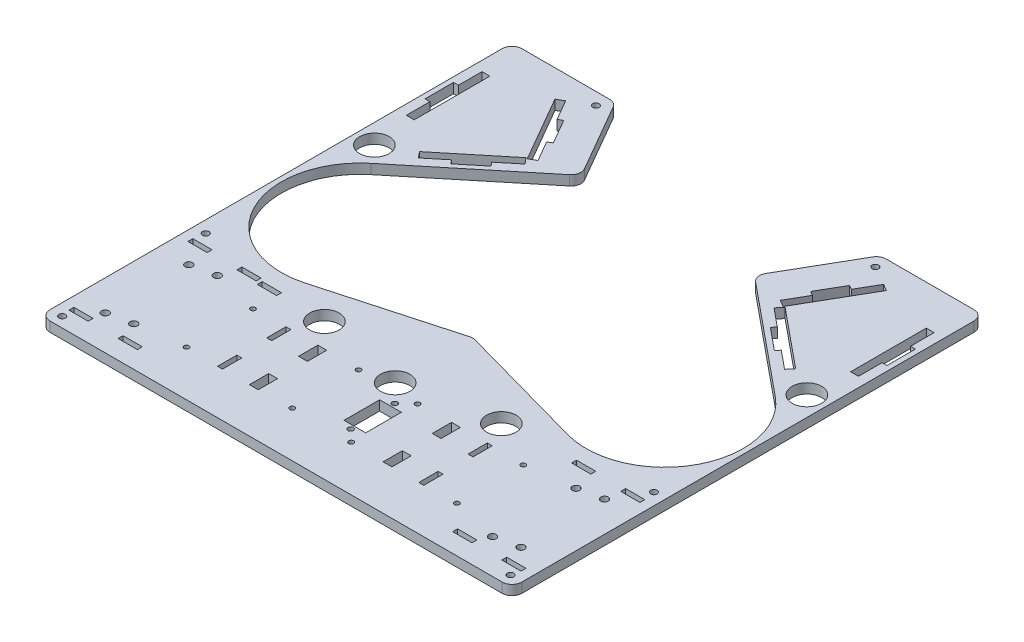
SolidWorks part; units mm, degrees
ref_plane "Front" through (0, 0, 0) normal (0, 0, 1) x (1, 0, 0)
ref_plane "Top" through (0, 0, 0) normal (0, 1, 0) x (1, 0, 0)
ref_plane "Right" through (0, 0, 0) normal (1, 0, 0) x (0, 0, -1)
sketch "Sketch1" plane through (0, 0, 0) normal (0, 1, 0) x (1, 0, 0)
  line L0 (-146.05, 0) -> (146.05, 0)
  line L1 (-152.4, 6.35) -> (-152.4, 298.45)
  line L2 (-149.225, 263.8519) -> (-152.4, 263.8519) construction
  line L3 (-83.1152, 262.2232) -> (-66.6174, 271.7482) construction
  line L4 (-58.5756, 257.8194) -> (-83.8668, 301.625)
  line L5 (-60.0496, 249.7331) -> (-130.6265, 191.8892)
  line L6 (-85.8648, 260.6357) -> (-78.2448, 247.4375)
  line L7 (-66.6125, 72.9976) -> (-63.4375, 72.9976)
  line L8 (-66.6125, 72.9976) -> (-66.6125, 60.5516)
  line L9 (-66.6125, 60.5516) -> (-63.4375, 60.5516)
  line L10 (-63.4375, 72.9976) -> (-63.4375, 60.5516)
  line L11 (-46.0375, 72.9976) -> (-40.3225, 72.9976)
  line L12 (-46.0375, 72.9976) -> (-46.0375, 60.5516)
  line L13 (-46.0375, 60.5516) -> (-40.3225, 60.5516)
  line L14 (-146.05, 263.8519) -> (-146.05, 279.0919)
  line L15 (-40.3225, 72.9976) -> (-40.3225, 60.5516)
  line L16 (-1108.9025, 50.8996) -> (48891.0975, 50.8996) construction
  line L17 (-40.3225, 28.8016) -> (-40.3225, 41.2476)
  line L18 (-46.0375, 41.2476) -> (-40.3225, 41.2476)
  line L19 (1.7012, 126.7679) -> (84.8154, 103.6562)
  line L20 (-146.05, 304.8) -> (-89.366, 304.8)
  line L21 (0, -1000) -> (0, 49000) construction
  line L22 (-1.7012, 126.7679) -> (-84.8154, 103.6562)
  line L23 (-146.05, 279.0919) -> (-140.97, 279.0919)
  line L24 (-98.425, 152.5992) -> (98.425, 152.5992) construction
  line L25 (-98.425, 152.5992) -> (0, 177.8) construction
  line L26 (0, 177.8) -> (98.425, 152.5992) construction
  line L27 (146.05, 304.8) -> (89.366, 304.8)
  line L28 (60.0496, 249.7331) -> (130.6265, 191.8892)
  line L29 (58.5756, 257.8194) -> (83.8668, 301.625)
  line L30 (152.4, 6.35) -> (152.4, 298.45)
  line L31 (-46.0375, 28.8016) -> (-46.0375, 41.2476)
  line L32 (-146.05, 230.1969) -> (-140.97, 230.1969)
  line L33 (-146.05, 245.4369) -> (-146.05, 230.1969)
  line L34 (-140.97, 279.0919) -> (-140.97, 230.1969)
  line L35 (-78.2448, 247.4375) -> (-82.6442, 244.8975)
  line L36 (-83.1152, 262.2232) -> (-85.8648, 260.6357)
  line L37 (-83.1152, 262.2232) -> (-92.3227, 278.1711)
  line L38 (-104.472, 217.4302) -> (-102.4594, 214.9746) construction
  line L39 (-106.4846, 219.8859) -> (-118.2716, 210.2254)
  line L40 (-149.225, 263.8519) -> (-146.05, 263.8519)
  line L41 (-149.225, 263.8519) -> (-149.225, 245.4369)
  line L42 (-149.225, 245.4369) -> (-146.05, 245.4369)
  line L43 (-118.2716, 210.2254) -> (-121.4917, 214.1544)
  line L44 (-104.472, 217.4302) -> (-106.4846, 219.8859)
  line L45 (-104.472, 217.4302) -> (-90.2294, 229.1033)
  line L46 (-117.708, 304.8) -> (-117.708, 202.477) construction
  line L47 (-146.05, 89.027) -> (-146.05, 92.202)
  line L48 (-146.05, 89.027) -> (-133.604, 89.027)
  line L49 (-133.604, 89.027) -> (-133.604, 92.202)
  line L50 (107.0917, 287.2418) -> (82.6442, 244.8975)
  line L51 (-46.0375, 28.8016) -> (-40.3225, 28.8016)
  line L52 (-63.4375, 28.8016) -> (-63.4375, 41.2476)
  line L53 (-66.6125, 41.2476) -> (-63.4375, 41.2476)
  line L54 (-66.6125, 28.8016) -> (-66.6125, 41.2476)
  line L55 (-66.6125, 28.8016) -> (-63.4375, 28.8016)
  line L56 (66.6125, 28.8016) -> (63.4375, 28.8016)
  line L57 (-90.2294, 229.1033) -> (-92.242, 231.5589)
  line L58 (-80.455, 241.2194) -> (-83.6751, 245.1484)
  line L59 (-92.242, 231.5589) -> (-80.455, 241.2194)
  line L60 (-121.4917, 214.1544) -> (-83.6751, 245.1484)
  line L61 (66.6125, 28.8016) -> (66.6125, 41.2476)
  line L62 (66.6125, 41.2476) -> (63.4375, 41.2476)
  line L63 (63.4375, 28.8016) -> (63.4375, 41.2476)
  line L64 (46.0375, 28.8016) -> (40.3225, 28.8016)
  line L65 (46.0375, 28.8016) -> (46.0375, 41.2476)
  line L66 (46.0375, 41.2476) -> (40.3225, 41.2476)
  line L67 (40.3225, 28.8016) -> (40.3225, 41.2476)
  line L68 (40.3225, 72.9976) -> (40.3225, 60.5516)
  line L69 (46.0375, 60.5516) -> (40.3225, 60.5516)
  line L70 (46.0375, 72.9976) -> (46.0375, 60.5516)
  line L71 (46.0375, 72.9976) -> (40.3225, 72.9976)
  line L72 (63.4375, 72.9976) -> (63.4375, 60.5516)
  line L73 (-92.3227, 278.1711) -> (-95.0723, 276.5836)
  line L74 (-102.6923, 289.7818) -> (-107.0917, 287.2418)
  line L75 (-95.0723, 276.5836) -> (-102.6923, 289.7818)
  line L76 (-107.0917, 287.2418) -> (-82.6442, 244.8975)
  line L77 (66.6125, 60.5516) -> (63.4375, 60.5516)
  line L78 (66.6125, 72.9976) -> (66.6125, 60.5516)
  line L79 (66.6125, 72.9976) -> (63.4375, 72.9976)
  line L80 (95.0723, 276.5836) -> (102.6923, 289.7818)
  line L81 (102.6923, 289.7818) -> (107.0917, 287.2418)
  line L82 (92.3227, 278.1711) -> (95.0723, 276.5836)
  line L83 (121.4917, 214.1544) -> (83.6751, 245.1484)
  line L84 (92.242, 231.5589) -> (80.455, 241.2194)
  line L85 (80.455, 241.2194) -> (83.6751, 245.1484)
  line L86 (90.2294, 229.1033) -> (92.242, 231.5589)
  line L87 (104.472, 217.4302) -> (90.2294, 229.1033)
  line L88 (-71.2212, 279.7222) -> (43230.049, 25279.7222) construction
  line L89 (-95.3381, 220.8111) -> (31599.0975, -38450.4024) construction
  line L90 (104.472, 217.4302) -> (106.4846, 219.8859)
  line L91 (118.2716, 210.2254) -> (121.4917, 214.1544)
  line L92 (149.225, 245.4369) -> (146.05, 245.4369)
  line L93 (149.225, 263.8519) -> (149.225, 245.4369)
  line L94 (149.225, 263.8519) -> (146.05, 263.8519)
  line L95 (106.4846, 219.8859) -> (118.2716, 210.2254)
  line L96 (-65.025, 60.5516) -> (-65.025, 41.2476) construction
  line L97 (83.1152, 262.2232) -> (92.3227, 278.1711)
  line L98 (83.1152, 262.2232) -> (85.8648, 260.6357)
  line L99 (78.2448, 247.4375) -> (82.6442, 244.8975)
  line L100 (140.97, 279.0919) -> (140.97, 230.1969)
  line L101 (146.05, 245.4369) -> (146.05, 230.1969)
  line L102 (-64.0748, 254.6444) -> (-50064.0748, 254.6444) construction
  line L103 (146.05, 230.1969) -> (140.97, 230.1969)
  line L104 (146.05, 279.0919) -> (140.97, 279.0919)
  line L105 (146.05, 263.8519) -> (146.05, 279.0919)
  line L106 (85.8648, 260.6357) -> (78.2448, 247.4375)
  line L107 (-146.05, 92.202) -> (-133.604, 92.202)
  line L108 (-101.854, 92.202) -> (-114.3, 92.202)
  line L109 (-114.3, 89.027) -> (-114.3, 92.202)
  line L110 (-101.854, 89.027) -> (-114.3, 89.027)
  line L111 (-101.854, 89.027) -> (-101.854, 92.202)
  line L112 (-133.604, 90.6145) -> (-114.3, 90.6145) construction
  line L113 (-101.854, 15.367) -> (-101.854, 12.192)
  line L114 (-101.854, 15.367) -> (-114.3, 15.367)
  line L115 (-114.3, 15.367) -> (-114.3, 12.192)
  line L116 (-101.854, 12.192) -> (-114.3, 12.192)
  line L117 (-146.05, 12.192) -> (-133.604, 12.192)
  line L118 (-133.604, 15.367) -> (-133.604, 12.192)
  line L119 (-146.05, 15.367) -> (-133.604, 15.367)
  line L120 (-146.05, 15.367) -> (-146.05, 12.192)
  line L121 (101.854, 89.027) -> (101.854, 92.202)
  line L122 (101.854, 89.027) -> (114.3, 89.027)
  line L123 (114.3, 89.027) -> (114.3, 92.202)
  line L124 (101.854, 92.202) -> (114.3, 92.202)
  line L125 (146.05, 92.202) -> (133.604, 92.202)
  line L126 (133.604, 89.027) -> (133.604, 92.202)
  line L127 (146.05, 89.027) -> (133.604, 89.027)
  line L128 (146.05, 89.027) -> (146.05, 92.202)
  line L129 (101.854, 12.192) -> (114.3, 12.192)
  line L130 (114.3, 15.367) -> (114.3, 12.192)
  line L131 (101.854, 15.367) -> (114.3, 15.367)
  line L132 (101.854, 15.367) -> (101.854, 12.192)
  line L133 (146.05, 15.367) -> (146.05, 12.192)
  line L134 (146.05, 15.367) -> (133.604, 15.367)
  line L135 (133.604, 15.367) -> (133.604, 12.192)
  line L136 (146.05, 12.192) -> (133.604, 12.192)
  line L137 (-98.425, 101.7992) -> (-98.425, 0) construction
  line L138 (-87.122, 87.4121) -> (-87.122, 90.5871)
  line L139 (-99.568, 90.5871) -> (-87.122, 90.5871)
  line L140 (-99.568, 87.4121) -> (-99.568, 90.5871)
  line L141 (-99.568, 87.4121) -> (-87.122, 87.4121)
  line L142 (-87.3125, 72.3309) -> (-87.3125, 29.4684) construction
  line L143 (-87.3125, 29.4684) -> (-19.05, 29.4684) construction
  line L144 (-19.05, 29.4684) -> (-19.05, 72.3309) construction
  line L145 (-19.05, 72.3309) -> (-87.3125, 72.3309) construction
  line L146 (4.4827, 62.3996) -> (18.4827, 62.3996)
  line L147 (4.4827, 62.3996) -> (4.4827, 39.3996)
  line L148 (4.4827, 39.3996) -> (18.4827, 39.3996)
  line L149 (18.4827, 62.3996) -> (18.4827, 39.3996)
  line L150 (11.4827, 62.3996) -> (11.4827, 39.3996) construction
  circle A0 centre (-98.425, 152.5992) radius 50.8 construction
  circle A1 centre (0, 76.9346) radius 9.525
  circle A2 centre (-144.78, 99.314) radius 2.0955
  circle A3 centre (0, 177.8) radius 50.8 construction
  circle A4 centre (98.425, 152.5992) radius 50.8 construction
  circle A5 centre (-144.78, 6.604) radius 2.0955
  arc A6 (-130.6265, 191.8892) -> (-84.8154, 103.6562) centre (-98.425, 152.5992) ccw
  circle A7 centre (144.78, 6.604) radius 2.0955
  circle A8 centre (144.78, 99.314) radius 2.0955
  arc A9 (-146.05, 0) -> (-152.4, 6.35) centre (-146.05, 6.35) cw
  arc A10 (-58.5756, 257.8194) -> (-60.0496, 249.7331) centre (-64.0748, 254.6444) cw
  circle A11 centre (-144.78, 99.314) radius 4.7625 construction
  arc A12 (-152.4, 298.45) -> (-146.05, 304.8) centre (-146.05, 298.45) cw
  circle A13 centre (-117.475, 79.4746) radius 2.3813
  circle A14 centre (-132.715, 76.2996) radius 2.3813
  circle A15 centre (117.475, 76.2996) radius 2.3813
  circle A16 centre (132.715, 79.4746) radius 2.3813
  arc A17 (-89.366, 304.8) -> (-83.8668, 301.625) centre (-89.366, 298.45) cw
  arc A18 (89.366, 304.8) -> (83.8668, 301.625) centre (89.366, 298.45) ccw
  arc A19 (152.4, 298.45) -> (146.05, 304.8) centre (146.05, 298.45) ccw
  arc A20 (58.5756, 257.8194) -> (60.0496, 249.7331) centre (64.0748, 254.6444) ccw
  arc A21 (146.05, 0) -> (152.4, 6.35) centre (146.05, 6.35) ccw
  arc A22 (130.6265, 191.8892) -> (84.8154, 103.6562) centre (98.425, 152.5992) cw
  circle A23 centre (-132.715, 22.3246) radius 2.3813
  circle A24 centre (-117.475, 25.4996) radius 2.3813
  arc A25 (-1.7012, 126.7679) -> (1.7012, 126.7679) centre (0, 120.65) cw
  circle A26 centre (117.475, 22.3246) radius 2.3813
  circle A27 centre (132.715, 25.4996) radius 2.3813
  circle A28 centre (-57.15, 88.3646) radius 9.525
  circle A29 centre (57.15, 88.3646) radius 9.525
  circle A30 centre (-87.3125, 29.4684) radius 1.5875
  circle A31 centre (-19.05, 29.4684) radius 1.5875
  circle A32 centre (-87.3125, 72.3309) radius 1.5875
  circle A33 centre (-19.05, 72.3309) radius 1.5875
  circle A34 centre (87.3125, 72.3309) radius 1.5875
  circle A35 centre (19.05, 72.3309) radius 1.5875
  circle A36 centre (19.05, 29.4684) radius 1.5875
  circle A37 centre (87.3125, 29.4684) radius 1.5875
  circle A38 centre (-139.7, 203.2) radius 9.525
  circle A39 centre (139.7, 203.2) radius 9.525
  circle A40 centre (-90.2826, 296.8625) radius 2.0955
  circle A41 centre (90.2826, 296.8625) radius 2.0955
  circle A42 centre (11.4827, 65.1496) radius 1.75
  circle A43 centre (11.4827, 36.6496) radius 1.75
  point P3 (-149.225, 254.6444)
  point P8 (-87.719, 270.1972)
  point P17 (-55.88, 253.1505)
  point P26 (-97.3507, 223.2668)
  point P31 (-152.4, 0)
  point P32 (0, 0)
  point P42 (0, 127)
  point P118 (55.88, 253.1505)
  point P125 (-123.952, 90.6145)
  point P166 (-71.2212, 279.7222)
  point P169 (-95.3381, 220.8111)
  point P181 (-65.025, 50.8996)
  point P194 (-98.425, 50.8996)
  point P228 (-19.05, 50.8996)
  point P249 (4.4827, 50.8996)
  dimension "D8" = 3.175
  dimension "D9" = 5.08
  dimension "D11" = 26.035
  dimension "D12" = 56.684
  dimension "D13" = 18.415
  dimension "D15" = 196.85
  dimension "D16" = 6.35
  dimension "D21" = 304.8
  dimension "D23" = 55.88
  dimension "D24" = 6.35
  dimension "D25" = 127
  dimension "D26" = 6.35
  dimension "D6" = 53.975
  dimension "D10" = 101.6
  dimension "D27" = 4.191
  dimension "D30" = 4.7625
  dimension "D37" = 19.05
  dimension "D40" = 3.175
  dimension "D46" = 19.05
  dimension "D47" = 12.192
  dimension "D52" = 9.525
  dimension "D55" = 3.5
  dimension "D3" = 17.4
  dimension "D4" = 3.175
  dimension "D5" = 12.446
  dimension "D7" = 15.24
  dimension "D14" = 73.66
  dimension "D17" = 5.715
  dimension "D18" = 6.35
  dimension "D19" = 92.71
  dimension "D20" = 7.62
  dimension "D22" = 30
  dimension "D28" = 19.304
  dimension "D29" = 40.3225
  dimension "D31" = 19.685
  dimension "D32" = 15.24
  dimension "D33" = 3.175
  dimension "D34" = 25.4
  dimension "D35" = 87.122
  dimension "D36" = 36.5125
  dimension "D38" = 37.465
  dimension "D39" = 57.15
  dimension "D41" = 68.2625
  dimension "D42" = 42.8625
  dimension "D43" = 19.05
  dimension "D44" = 12.7
  dimension "D45" = 101.6
  dimension "D48" = 6.604
  dimension "D49" = 19.05
  dimension "D50" = 7.9375
  dimension "D51" = 7.9375
  dimension "D53" = 14
  dimension "D54" = 23
  dimension "D56" = 28.5
extrude "Extrude1" add sketch "Sketch1" along normal blind 6.35
